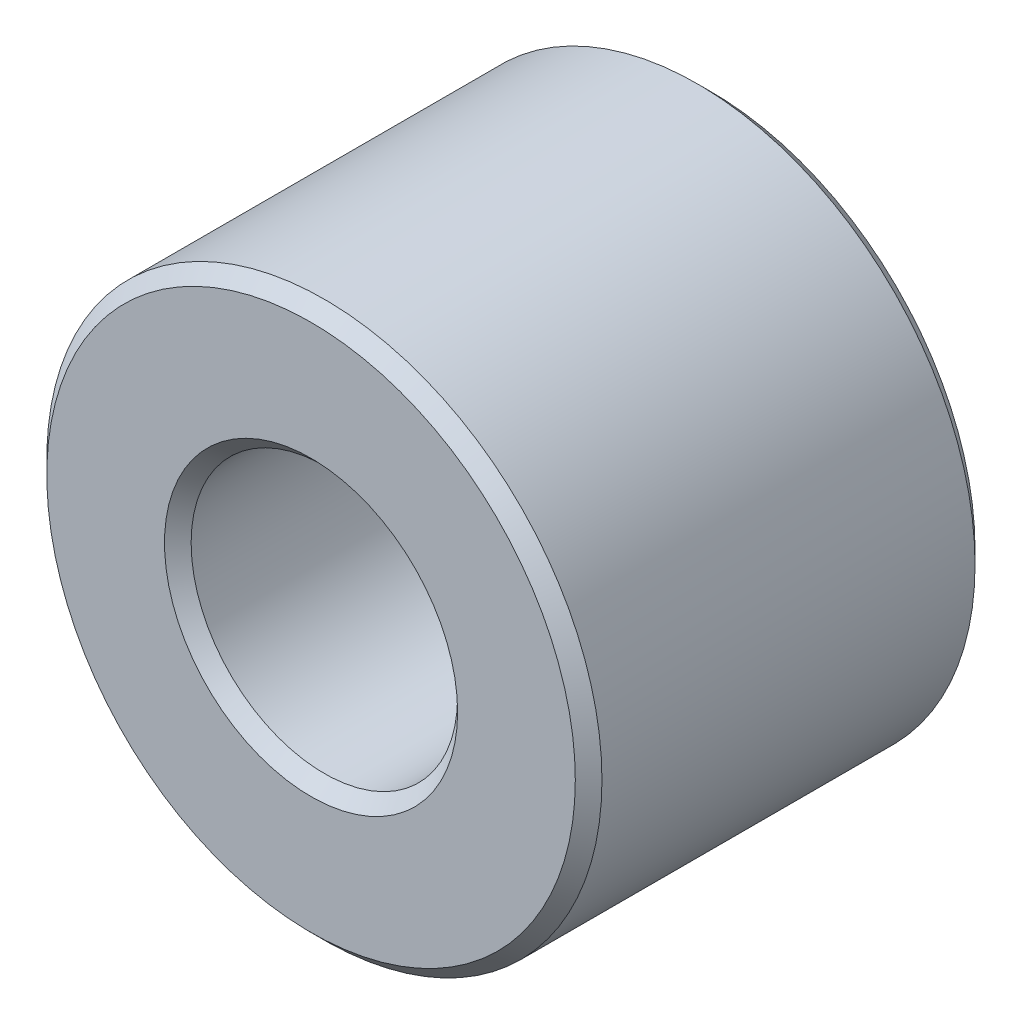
SolidWorks part; units mm, degrees
ref_plane "Front Plane" through (0, 0, 0) normal (0, 0, 1) x (1, 0, 0)
ref_plane "Top Plane" through (0, 0, 0) normal (0, 1, 0) x (1, 0, 0)
ref_plane "Right Plane" through (0, 0, 0) normal (1, 0, 0) x (0, 0, -1)
sketch "Sketch1" plane through (0, 0, 0) normal (0, 0, 1) x (1, 0, 0)
  circle A0 centre (0, 0) radius 18
  circle A1 centre (0, 0) radius 37.5
  dimension "D1" = 36
  dimension "D2" = 75
extrude "Boss-Extrude1" add sketch "Sketch1" along normal mid plane 54
chamfer "Chamfer1" distance 1.8 angle 45 4 edges at (18, 0, -27) (37.5, 0, -27) (18, 0, 27) (37.5, 0, 27)
